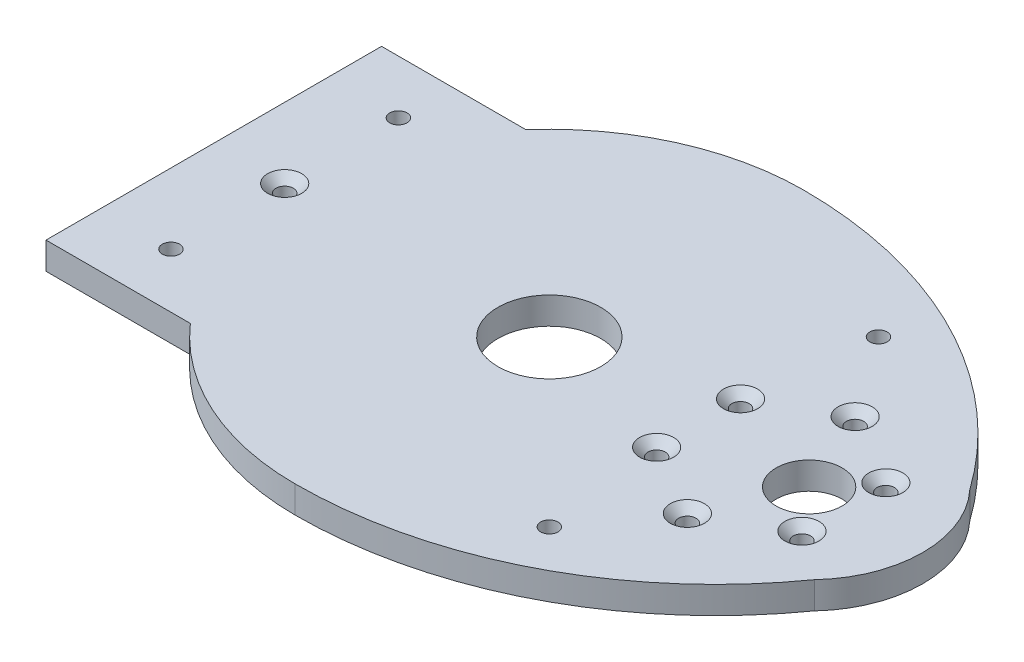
SolidWorks part; units mm, degrees
ref_plane "Front Plane" through (0, 0, 0) normal (0, 0, 1) x (1, 0, 0)
ref_plane "Top Plane" through (0, 0, 0) normal (0, 1, 0) x (1, 0, 0)
ref_plane "Right Plane" through (0, 0, 0) normal (1, 0, 0) x (0, 0, -1)
sketch "Sketch1" plane through (0, 0, 0) normal (0, 1, 0) x (1, 0, 0)
  line L2 (68, -47) -> (0, -47)
  line L4 (-62, 31) -> (-62, -31)
  line L5 (-62, 31) -> (-35.327, 31)
  line L6 (-62, -31) -> (-35.327, -31)
  circle A0 centre (0, 0) radius 37 construction
  circle A1 centre (0, 0) radius 47
  circle A2 centre (48, 0) radius 6.1
  circle A3 centre (0, 0) radius 9.5
  circle A4 centre (0, 0) radius 47 construction
  arc A6 (-35.327, 31) -> (-35.327, -31) centre (0, 0) cw
  circle A7 centre (48, 0) radius 18.5 construction
  arc A8 (0, 47) -> (63.3152, 14.3682) centre (0, -30.7409) cw
  arc A9 (0, -47) -> (63.3152, -14.3682) centre (0, 30.7409) ccw
  arc A10 (63.3152, -14.3682) -> (63.3152, 14.3682) centre (48, 0) ccw
  circle A11 centre (48, 0) radius 21 construction
  point P17 (-62, 0)
  dimension "D1" = 74
  dimension "D3" = 12.2
  dimension "D6" = 19
  dimension "D10" = 57
  dimension "D9" = 37
  dimension "D11" = 57
  dimension "D4" = 48
  dimension "D7" = 62
  dimension "D8" = 62
  dimension "D2" = 10
  dimension "D12" = 2.5
extrude "Boss-Extrude1" add sketch "Sketch1" along normal blind 5 contours A2 A1 | A1 L5 L4 L6 | A9 A10 A8 A1 A2
sketch "Sketch2" plane through (0, 5, 0) normal (0, 1, 0) x (1, 0, 0)
  circle A0 centre (41, 0) radius 15.5 construction
  circle A1 centre (48, 0) radius 6.1 construction
  circle A2 centre (48, 0) radius 6.1 construction
  circle A3 centre (41, -15.5) radius 1.6
  circle A4 centre (27.5766, -7.75) radius 1.6
  circle A5 centre (27.5766, 7.75) radius 1.6
  circle A6 centre (41, 15.5) radius 1.6
  circle A7 centre (54.4234, 7.75) radius 1.6
  circle A8 centre (54.4234, -7.75) radius 1.6
  point P20 (41, 0)
  dimension "D1" = 31
  dimension "D3" = 3.2
  dimension "D2" = 7
  dimension "D4" = 6
hole_wizard "CSK for M3 Countersunk Flat Head Screw1" positions "Sketch3" profile "Sketch4" countersink size "M3" standard "ISO"
sketch "Sketch3" plane through (0, 5, 0) normal (0, 1, 0) x (1, 0, 0)
  point P0 (27.5766, 7.75)
  point P3 (41, 15.5)
  point P6 (27.5766, -7.75)
  point P9 (41, -15.5)
  point P12 (54.4234, -7.75)
  point P15 (54.4234, 7.75)
sketch "Sketch4" plane through (27.5766, 5, -7.75) normal (1, 0, 0) x (0, 0, 1)
  line L0 (0, 0) -> (0, 10.4614)
  line L1 (0, 10.4614) -> (1.6, 9.5)
  line L2 (1.6, 9.5) -> (1.6, 1.55)
  line L3 (1.6, 1.55) -> (3.15, 0)
  line L5 (3.15, 0) -> (0, 0)
  line L6 (-1.6, 1.55) -> (-3.15, 0) construction
  line L10 (0, 10.4614) -> (-1.6, 9.5) construction
  line L11 (0, -6.35) -> (0, 107.95) construction
  dimension "Hole Dia." = 3.2
  dimension "Hole Depth" = 9.5
  dimension "Near C'Sink Dia." = 6.3
  dimension "Near C'Sink Angle" = 90
  dimension "Drill Angle" = 118
sketch "Sketch5" plane through (0, 5, 0) normal (0, 1, 0) x (1, 0, 0)
  circle A0 centre (0, 0) radius 37 construction
  dimension "D1" = 74
sketch "Sketch10" plane through (0, 0, 0) normal (0, -1, 0) x (1, 0, 0)
  line L0 (0, 0) -> (0, 43) construction
  line L1 (0, 0) -> (30.4056, 30.4056) construction
  circle A0 centre (0, 0) radius 37 construction
  circle A1 centre (0, 0) radius 37 construction
  circle A2 centre (-49, 0) radius 14 construction
  circle A3 centre (0, 0) radius 43 construction
  circle A4 centre (30.4056, 30.4056) radius 1.25
  dimension "D1" = 49
  dimension "D2" = 28
  dimension "D4" = 2.5
  dimension "D3" = 86
  dimension "D5" = 45
hole_wizard "CSK for M3 Countersunk Flat Head Screw2" positions "Sketch11" profile "Sketch12" countersink size "M3" standard "ISO"
sketch "Sketch11" plane through (0, 0, 0) normal (0, -1, 0) x (-1, 0, 0)
  circle A0 centre (0, 0) radius 43 construction
  point P0 (-30.4056, -30.4056)
  point P7 (-30.4056, 30.4056)
sketch "Sketch12" plane through (30.4056, 0, 30.4056) normal (1, 0, 0) x (0, 0, -1)
  line L0 (0, 0) -> (0, 5)
  line L1 (0, 5) -> (1.6, 5)
  line L2 (1.6, 5) -> (1.6, 1.55)
  line L3 (1.6, 1.55) -> (3.15, 0)
  line L5 (3.15, 0) -> (0, 0)
  line L6 (-1.6, 1.55) -> (-3.15, 0) construction
  line L11 (0, -6.35) -> (0, 107.95) construction
  dimension "Thru Hole Dia." = 3.2
  dimension "Thru Hole Depth" = 5
  dimension "Near C'Sink Dia." = 6.3
  dimension "Near C'Sink Angle" = 90
sketch "Sketch6" plane through (0, 0, 0) normal (0, -1, 0) x (1, 0, 0)
  circle A0 centre (-49, -21.11) radius 1.6
  circle A1 centre (-49, 20.91) radius 1.6
  circle A2 centre (-49, -0.1) radius 1.6
  circle A3 centre (-49, 0) radius 14 construction
  circle A4 centre (-49, 0) radius 14 construction
extrude "Cut-Extrude2" cut sketch "Sketch6" against normal through all
hole_wizard "CSK for M3 Countersunk Flat Head Screw3" positions "Sketch13" profile "Sketch14" countersink size "M3" standard "ISO"
sketch "Sketch13" plane through (0, 5, 0) normal (0, 1, 0) x (1, 0, 0)
  point P0 (-49, 0.1)
sketch "Sketch14" plane through (-49, 5, -0.1) normal (1, 0, 0) x (0, 0, 1)
  line L0 (0, 0) -> (0, 5)
  line L1 (0, 5) -> (1.6, 5)
  line L2 (1.6, 5) -> (1.6, 1.55)
  line L3 (1.6, 1.55) -> (3.15, 0)
  line L5 (3.15, 0) -> (0, 0)
  line L6 (-1.6, 1.55) -> (-3.15, 0) construction
  line L11 (0, -6.35) -> (0, 107.95) construction
  dimension "Thru Hole Dia." = 3.2
  dimension "Thru Hole Depth" = 5
  dimension "Near C'Sink Dia." = 6.3
  dimension "Near C'Sink Angle" = 90
equation "\"D6@Sketch6\"=\"D5@Sketch6\"/2"
